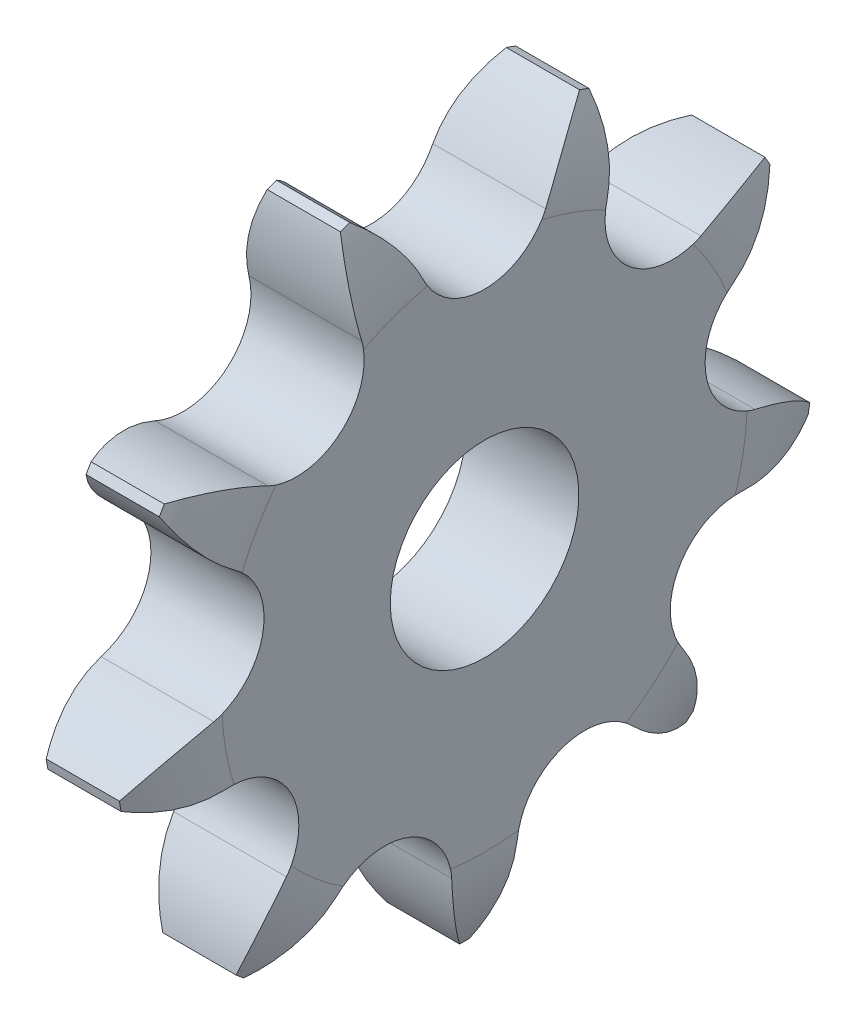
SolidWorks part; units mm, degrees
ref_plane "Plane1" through (0, 0, 0) normal (0, 0, 1) x (1, 0, 0)
ref_plane "Plane2" through (0, 0, 0) normal (0, 1, 0) x (1, 0, 0)
ref_plane "Plane3" through (0, 0, 0) normal (1, 0, 0) x (0, 0, -1)
sketch "Clipboard" plane through (0, 0, 0) normal (0, 1, 0) x (1, 0, 0)
  line L0 (0, 0) -> (12.5436, -1.9867)
  line L1 (-15, 0) -> (100, 0) construction
  line L2 (0, 0) -> (-0.8416, 0.9512)
  line L3 (0, 0) -> (-11.863, 4.5341)
  line L4 (0, 0) -> (3.0618, 0.4849)
  line L5 (0, 0) -> (-2.8109, -1.0484)
  line L6 (0, 0) -> (-5.9685, -4.027)
  line L7 (-0.8416, 0.9512) -> (8.4161, 2.5835)
  line L8 (-76.2, 38.1) -> (-75.2, 38.1)
  line L9 (-73.4259, 41.6592) -> (-72.8306, 41.7344)
  line L10 (-73.4741, 12.7512) -> (-59.5541, 12.7512)
  circle A0 centre (0, 0) radius 4.255
  circle A1 centre (0, 0) radius 10.1515
  circle A2 centre (0, 0) radius 25
  dimension "Dr" = 8.51
  dimension "MHD" = 20.303
  dimension "Hub_dia" = 50
  dimension "Num_teeth" = 9
  dimension "Pitch" = 12.7
  dimension "Width" = 3.1
  dimension "Side_relief" = 1.27
  dimension "Side_radius" = 12.7
  dimension "Overall_len" = 3
  dimension "Show_teeth" = 9
  dimension "Thickness" = 7.2
  dimension "OAL" = 9.4005
  dimension "T_dim" = 1
  dimension "Fillet_rad" = 0.6
  dimension "Face_width" = 7.2
  dimension "Num_strands" = 1
  dimension "Transv_pitch" = 13.92
  dimension "Plate_wid" = 11.8
sketch "BasProSke" plane through (0, 0, 0) normal (0, 1, 0) x (1, 0, 0)
  line L0 (-10, 0) -> (60, 0) construction
  line L1 (0, 0) -> (0, 16.7129)
  line L2 (0, 0) -> (7.2, 0)
  line L3 (7.2, 0) -> (7.2, 16.7129)
  line L4 (5.93, 22.2487) -> (1.27, 22.2487)
  arc A0 (0, 16.7129) -> (1.27, 22.2487) centre (12.7, 16.7129) cw
  arc A1 (7.2, 16.7129) -> (5.93, 22.2487) centre (-5.5, 16.7129) ccw
  dimension "D1" = 12.7
  dimension "G1" = 1.27
  dimension "G2" = 1.27
  dimension "Diameter" = 44.4973
  dimension "Thickness" = 7.2
revolve "Base-Revolve" add sketch "BasProSke" angle 360 about L0
sketch "TooCutSke" plane through (0, 0, 0) normal (1, 0, 0) x (0, 0, -1)
  line L0 (0, 18.6087) -> (3.8949, 16.7925) construction
  line L1 (0, 0) -> (0, 107) construction
  line L2 (0, 18.6087) -> (-10, 18.6087) construction
  line L3 (0, 18.6087) -> (-3.8949, 16.7925) construction
  arc A0 (3.8949, 16.7925) -> (7.8075, 21.3669) centre (14.0756, 12.0451) cw
  arc A1 (3.8949, 16.7925) -> (-3.8949, 16.7925) centre (0, 18.6087) cw
  arc A2 (-3.8949, 16.7925) -> (-7.8075, 21.3669) centre (-14.0756, 12.0451) ccw
  arc A3 (7.8075, 21.3669) -> (-7.8075, 21.3669) centre (0, 0) ccw
  dimension "R1" = 4.2976
  dimension "R2" = 11.2332
  dimension "Overcut" = 22.7487
  dimension "Seat_radius" = 18.6087
  dimension "X" = 130
extrude "ToothCut" cut sketch "TooCutSke" along normal through all
pattern_circular "TeethCuts" count 9 every 40 about axis through (-10, 0, 0) along (1, 0, 0) of "ToothCut"
sketch "HubNeaOneSke" plane through (0, 0, 0) normal (-1, 0, 0) x (0, 0, 1)
  circle A0 centre (0, 0) radius 10.1515
  dimension "Diameter" = 20.303
extrude "HubNearOne" [suppressed] add sketch "HubNeaOneSke" along normal blind 2.2005
fillet "HubNearOneFillet" [suppressed] radius 0.6
sketch "HubNeaBotSke" plane through (0, 0, 0) normal (-1, 0, 0) x (0, 0, 1)
  circle A0 centre (0, 0) radius 10.1515
  dimension "Diameter" = 20.303
extrude "HubNearBoth" [suppressed] add sketch "HubNeaBotSke" along normal blind 1.1003
fillet "HubNearBothFillet" [suppressed] radius 0.6
ref_plane "FarPln" through (7.2, 0, 0) normal (1, 0, 0) x (0, 0, -1)
sketch "HubFarSke" plane through (7.2, 0, 0) normal (1, 0, 0) x (0, 0, -1)
  circle A0 centre (0, 0) radius 10.1515
  dimension "Diameter" = 20.303
extrude "HubFar" [suppressed] add sketch "HubFarSke" along normal blind 1.1003
fillet "HubFarFillet" [suppressed] radius 0.6
sketch "BorSke" plane through (0, 0, 0) normal (1, 0, 0) x (0, 0, -1)
  circle A0 centre (0, 0) radius 6
  dimension "Diameter" = 12
extrude "Bore" cut sketch "BorSke" along normal mid plane 18.801
sketch "KeySke" plane through (0, 0, 0) normal (1, 0, 0) x (0, 0, -1)
  line L0 (-1, 0) -> (-1, 7)
  line L1 (-1, 7) -> (1, 7)
  line L2 (1, 7) -> (1, 0)
  line L3 (0, 0) -> (0, 34) construction
  line L4 (-1, 0) -> (1, 0)
  dimension "Offset" = 7
  dimension "Width" = 2
extrude "Keyway" [suppressed] cut sketch "KeySke" along normal mid plane 18.801
pattern_circular "Keyway2" [suppressed] count 2 every 90 about axis through (-10, 0, 0) along (1, 0, 0)
equation "' \"Pitch@Clipboard\" = 12.7"
equation "' \"Num_strands@Clipboard\" = 1"
equation "' \"Num_teeth@Clipboard\" = 9"
equation "' \"Hub_dia@Clipboard\" = 50"
equation "' \"Overall_len@Clipboard\" = 3"
equation "' \"Diameter@BorSke\" = 12"
equation "' \"T_dim@Clipboard\" = 1"
equation "' \"Width@KeySke\" = 2"
equation "' \"Dr@Clipboard\" = 8.51"
equation "' \"Face_width@Clipboard\" = 7.2"
equation "' \"Side_radius@Clipboard\" = 12.7"
equation "' \"Side_relief@Clipboard\" = 1.27"
equation "' \"Transv_pitch@Clipboard\" = 13.92"
equation "' \"Show_teeth@Clipboard\" = 9"
equation "' \"Fillet_rad@Clipboard\" = 0.6"
equation "' \"Plate_wid@Clipboard\" = 11.8"
equation "\"Num_teeth@Clipboard\" = int( \"Num_teeth@Clipboard\" )"
equation "\"Num_teeth@Clipboard\" = ((sgn( \"Num_teeth@Clipboard\" - 5.0)+1)*( \"Num_teeth@Clipboard\" - 5.0))/2 +5.0"
equation "\"Num_teeth@Clipboard\" = ((sgn( \"Num_teeth@Clipboard\" - 200.0)-1)*( \"Num_teeth@Clipboard\" - 200.0))/-2 +200.0"
equation "\"MHD@Clipboard\" = \"Pitch@Clipboard\" * (1.0 / tan(3.14159265 / \"Num_teeth@Clipboard\" )) - 1.05 * \"Plate_wid@Clipboard\" - 2.0 * \"Fillet_rad@Clipboard\" - 1.0"
equation "\"Thickness@Clipboard\"  = \"Face_width@Clipboard\" + (\"Num_strands@Clipboard\" - 1) * \"Transv_pitch@Clipboard\""
equation "\"OAL@Clipboard\" = \"Thickness@Clipboard\" + 2 * \"Fillet_rad@Clipboard\" + 1"
equation "\"MHD@Clipboard\" = ((sgn( \"MHD@Clipboard\" - \"Hub_dia@Clipboard\" )-1)*( \"MHD@Clipboard\" - \"Hub_dia@Clipboard\" ))/-2+ \"Hub_dia@Clipboard\""
equation "\"OAL@Clipboard\" = ((sgn( \"OAL@Clipboard\" - \"Overall_len@Clipboard\" )+1)*( \"OAL@Clipboard\" - \"Overall_len@Clipboard\" ))/2 + \"Overall_len@Clipboard\" + 0.0005"
equation "\"Num_teeth@TeethCuts\" = int( \"Show_teeth@Clipboard\" ) + 1"
equation "\"Num_teeth@TeethCuts\" = ((sgn( \"Num_teeth@TeethCuts\" - \"Num_teeth@Clipboard\" )-1)*( \"Num_teeth@TeethCuts\" - \"Num_teeth@Clipboard\" ))/-2+ \"Num_teeth@Clipboard\""
equation "\"Num_teeth@TeethCuts\" = ((sgn( \"Num_teeth@TeethCuts\" - 2.0)+1)*( \"Num_teeth@TeethCuts\" - 2.0))/2 +2.0"
equation "\"Angle@TeethCuts\" = 360.0 / \"Num_teeth@Clipboard\""
equation "\"Seat_radius@TooCutSke\" = ( \"Pitch@Clipboard\" / 2.0) / sin(3.14159265 / \"Num_teeth@Clipboard\" ) - \"Dr@Clipboard\" / 2.0 + \"Dr@Clipboard\" * 0.505"
equation "\"R1@TooCutSke\"  = \"Dr@Clipboard\" * 0.505"
equation "\"X@TooCutSke\" = 140.0 - (90.0 / \"Num_teeth@Clipboard\")"
equation "\"R2@TooCutSke\" = 0.12 * \"Dr@Clipboard\" * ( \"Num_teeth@Clipboard\" + 2.0)"
equation "\"Overcut@TooCutSke\" = 0.5 + 0.625 * \"Pitch@Clipboard\" - 0.5 * \"Dr@Clipboard\"  +  \"Pitch@Clipboard\" / 2.0 / sin(3.14159265 / \"Num_teeth@Clipboard\" )"
equation "\"Diameter@BasProSke\" = 2.0 * ( 0.625 * \"Pitch@Clipboard\" - 0.5 * \"Dr@Clipboard\"  +  \"Pitch@Clipboard\" / 2.0 / sin(3.14159265 / \"Num_teeth@Clipboard\" ))"
equation "\"Thickness@BasProSke\"  = \"Thickness@Clipboard\""
equation "\"G1@BasProSke\" =  \"Side_relief@Clipboard\""
equation "\"G2@BasProSke\" =  \"Side_relief@Clipboard\""
equation "\"D1@BasProSke\" =  \"Side_radius@Clipboard\""
equation "\"Diameter@HubNeaOneSke\" = \"MHD@Clipboard\""
equation "\"Length@HubNearOne\" = \"OAL@Clipboard\" - \"Thickness@BasProSke\""
equation "\"Diameter@HubNeaBotSke\" = \"MHD@Clipboard\""
equation "\"Length@HubNearBoth\" = ( \"OAL@Clipboard\" - \"Thickness@BasProSke\" ) / 2.0"
equation "\"D1@HubNearOneFillet\" = \"Fillet_rad@Clipboard\""
equation "\"D1@HubNearBothFillet\" = \"Fillet_rad@Clipboard\""
equation "\"Thickness@FarPln\" = \"Thickness@BasProSke\""
equation "\"Diameter@HubFarSke\" = \"MHD@Clipboard\""
equation "\"Length@HubFar\" = ( \"OAL@Clipboard\" - \"Thickness@BasProSke\" ) / 2.0"
equation "\"D1@HubFarFillet\" = \"Fillet_rad@Clipboard\""
equation "\"D1@Bore\" = \"OAL@Clipboard\" * 2.0"
equation "\"D1@Keyway\" = \"OAL@Clipboard\" * 2.0"
equation "\"Offset@KeySke\" = \"T_dim@Clipboard\" + \"Diameter@BorSke\" / 2.0"
